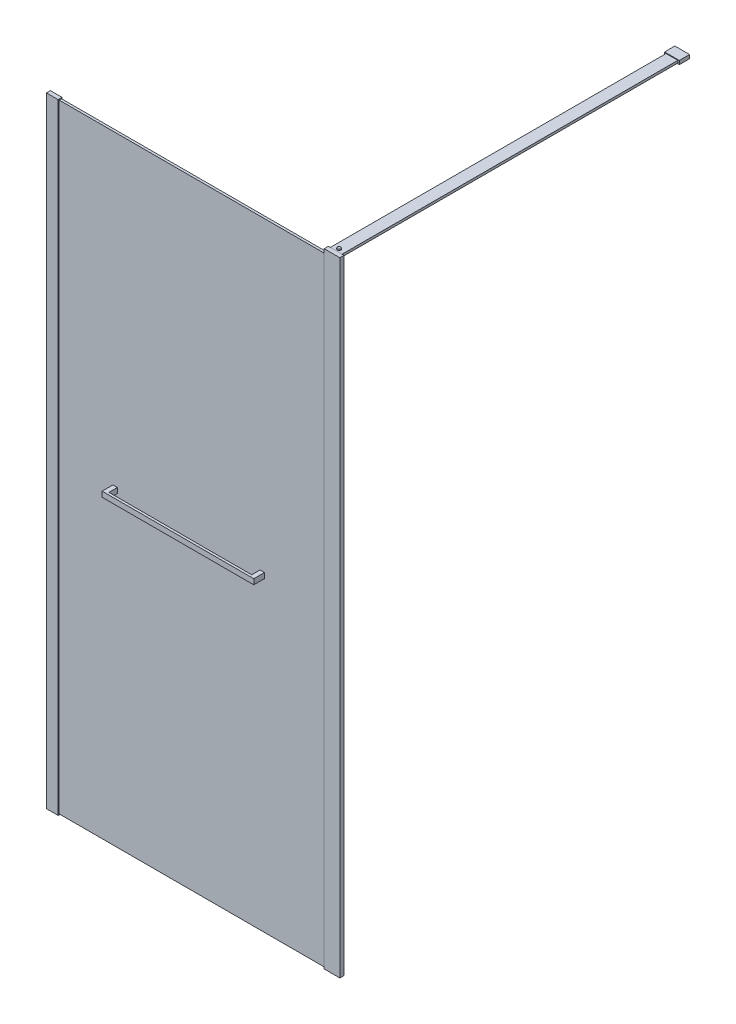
SolidWorks part; units mm, degrees
ref_plane "Płaszczyzna przednia" through (0, 0, 0) normal (0, 0, 1) x (1, 0, 0)
ref_plane "Płaszczyzna górna" through (0, 0, 0) normal (0, 1, 0) x (1, 0, 0)
ref_plane "Płaszczyzna prawa" through (0, 0, 0) normal (1, 0, 0) x (0, 0, -1)
sketch "Szkic1" plane through (0, 0, 0) normal (0, 1, 0) x (1, 0, 0)
  line L0 (0, 0) -> (0, 13.3)
  line L1 (0, 13.3) -> (40, 13.3)
  line L2 (40, 13.3) -> (40, 11.4)
  line L3 (40, 11.4) -> (6.5, 11.4)
  line L4 (6.5, 11.4) -> (6.5, 3.4)
  line L5 (6.5, 3.4) -> (40, 3.4)
  line L6 (40, 3.4) -> (40, 0)
  line L7 (40, 0) -> (0, 0)
  dimension "D1" = 40
  dimension "D2" = 13.3
  dimension "D3" = 33.5
  dimension "D4" = 1.9
  dimension "D5" = 8
extrude "Dodanie-wyciągnięcie1" add sketch "Szkic1" along normal blind 2100 from offset 3
sketch "Szkic2" plane through (0, 3, 0) normal (0, -1, 0) x (1, 0, 0)
  line L0 (6.5, -11.4) -> (40, -11.4) construction
  line L1 (6.5, -3.4) -> (953.5, -3.4)
  line L2 (6.5, -3.4) -> (6.5, -11.4)
  line L3 (6.5, -11.4) -> (953.5, -11.4)
  line L4 (953.5, -3.4) -> (953.5, -11.4)
  dimension "D1" = 947
extrude "Dodanie-wyciągnięcie2" add sketch "Szkic2" against normal blind 2100 separate body
sketch "Szkic3" plane through (0, 3, 0) normal (0, -1, 0) x (1, 0, 0)
  line L0 (943.4, -3.4) -> (943.4, -0.4)
  line L1 (953.5, -3.4) -> (6.5, -3.4) construction
  line L2 (943.4, -0.4) -> (996.4, -0.4)
  line L3 (996.4, -0.4) -> (996.4, -14.4)
  line L4 (996.4, -14.4) -> (943.4, -14.4)
  line L5 (943.4, -14.4) -> (943.4, -11.4)
  line L6 (943.4, -11.4) -> (953.5, -11.4)
  line L7 (953.5, -11.4) -> (953.5, -3.4)
  line L8 (953.5, -3.4) -> (943.4, -3.4)
  line L9 (6.5, -11.4) -> (953.5, -11.4) construction
  line L10 (953.5, -11.4) -> (953.5, -3.4) construction
  dimension "D1" = 10.1
  dimension "D2" = 3
  dimension "D3" = 3
  dimension "D4" = 53
extrude "Dodanie-wyciągnięcie3" add sketch "Szkic3" against normal blind 2108 separate body
sketch "Szkic4" plane through (0, 2103, 0) normal (0, 1, 0) x (1, 0, 0)
  line L1 (0, 13.3) -> (40, 13.3)
  line L2 (0, 13.3) -> (0, 0)
  line L3 (0, 0) -> (40, 0)
  line L4 (40, 13.3) -> (40, 0)
extrude "Dodanie-wyciągnięcie4" add sketch "Szkic4" along normal blind 3
sketch "Szkic5" plane through (0, 2111, 0) normal (0, 1, 0) x (1, 0, 0)
  line L1 (996.4, 14.4) -> (943.4, 14.4)
  line L2 (996.4, 14.4) -> (996.4, 0.4)
  line L3 (996.4, 0.4) -> (943.4, 0.4)
  line L4 (943.4, 14.4) -> (943.4, 0.4)
extrude "Dodanie-wyciągnięcie5" add sketch "Szkic5" along normal blind 8
sketch "Szkic6" plane through (943.4, 0, 0) normal (-1, 0, 0) x (0, 0, 1)
  line L0 (-11.4, 2111) -> (-3.4, 2111) construction
  line L1 (-3.35, 2111) -> (-11.45, 2111)
  line L2 (-3.35, 2111) -> (-3.35, 2103.2)
  line L3 (-3.35, 2103.2) -> (-11.45, 2103.2)
  line L4 (-11.45, 2111) -> (-11.45, 2103.2)
  point P6 (-7.4, 2111)
  dimension "D1" = 8.1
  dimension "D2" = 7.8
extrude "Dodanie-wyciągnięcie6" add sketch "Szkic6" against normal blind 15 from offset 1.3
sketch "Szkic7" plane through (0, 3, 0) normal (0, -1, 0) x (1, 0, 0)
  line L1 (943.4, -0.4) -> (996.4, -0.4)
  line L2 (943.4, -0.4) -> (943.4, -14.4)
  line L3 (943.4, -14.4) -> (996.4, -14.4)
  line L4 (996.4, -0.4) -> (996.4, -14.4)
extrude "Dodanie-wyciągnięcie7" add sketch "Szkic7" along normal blind 3
sketch "Szkic8" plane through (0, 3, 0) normal (0, -1, 0) x (1, 0, 0)
  line L1 (0, 0) -> (40, 0)
  line L2 (0, 0) -> (0, -13.3)
  line L3 (0, -13.3) -> (40, -13.3)
  line L4 (40, 0) -> (40, -13.3)
extrude "Dodanie-wyciągnięcie8" add sketch "Szkic8" along normal blind 3
sketch "Szkic9" plane through (0, 0, -14.4) normal (0, 0, -1) x (-1, 0, 0)
  line L0 (-996.4, 2119) -> (-943.4, 2119) construction
  line L1 (-989.9, 2119) -> (-949.9, 2119)
  line L2 (-989.9, 2119) -> (-989.9, 2111)
  line L3 (-989.9, 2111) -> (-949.9, 2111)
  line L4 (-949.9, 2119) -> (-949.9, 2111)
  line L5 (-996.4, 2119) -> (-996.4, 0) construction
  line L6 (-943.4, 2119) -> (-943.4, 0) construction
  dimension "D1" = 6.5
  dimension "D2" = 6.5
  dimension "D3" = 8
extrude "Dodanie-wyciągnięcie9" add sketch "Szkic9" along normal blind 1170 separate body
sketch "Szkic10" plane through (0, 0, -1184.4) normal (0, 0, -1) x (-1, 0, 0)
  line L0 (-969.9, 2119) -> (-969.9, 2115) construction
  line L1 (-994.9, 2121.25) -> (-944.9, 2121.25)
  line L2 (-994.9, 2121.25) -> (-994.9, 2108.75)
  line L3 (-994.9, 2108.75) -> (-944.9, 2108.75)
  line L4 (-944.9, 2121.25) -> (-944.9, 2108.75)
  line L5 (-994.9, 2121.25) -> (-944.9, 2108.75) construction
  line L6 (-994.9, 2108.75) -> (-944.9, 2121.25) construction
  line L7 (-949.9, 2119) -> (-989.9, 2119) construction
  line L8 (-969.9, 2115) -> (-989.9, 2115) construction
  line L9 (-989.9, 2119) -> (-989.9, 2111) construction
  point P0 (-969.9, 2115)
  dimension "D1" = 12.5
  dimension "D2" = 50
extrude "Dodanie-wyciągnięcie10" add sketch "Szkic10" along normal blind 35 from offset 29.4
ref_plane "Płaszczyzna1" through (969.9, 0, 0) normal (1, 0, 0) x (0, 0, -1)
sketch "Szkic11" plane through (969.9, 0, 0) normal (1, 0, 0) x (0, 0, -1)
  line L0 (24.4, 2119) -> (24.4, 2127.4416) construction
  line L1 (24.4, 2119) -> (34.6926, 2119) construction
  line L2 (30.3, 2119) -> (30.05, 2122.8)
  line L3 (24.4, 2124.7) -> (30.2413, 2124.7) construction
  line L4 (24.4, 2124.7) -> (24.4, 2124.2)
  line L5 (1155, 2119) -> (14.4, 2119) construction
  line L6 (14.4, 2119) -> (14.4, 2111) construction
  line L7 (29.7989, 2119) -> (30.3, 2119)
  line L9 (29.5663, 2122.5357) -> (29.7989, 2119)
  arc A0 (24.4, 2124.7) -> (30.05, 2122.8) centre (24.4, 2115.3493) cw
  arc A1 (29.5663, 2122.5357) -> (24.4, 2124.2) centre (24.4, 2115.3493) ccw
  dimension "D1" = 0.5
  dimension "D2" = 11.3
  dimension "D3" = 5.7
  dimension "D4" = 3.8
  dimension "D5" = 11.8
  dimension "D6" = 0.5
  dimension "D7" = 10
revolve "Obrót1" add sketch "Szkic11" angle 360 about L0
sketch "Szkic12" plane through (0, 0, -3.4) normal (0, 0, 1) x (1, 0, 0)
  line L0 (480, 1409.7928) -> (480, 762.3594) construction
  line L1 (230, 1053) -> (730, 1053) construction
  line L2 (6.5, 2103) -> (6.5, 3) construction
  line L3 (953.5, 2103) -> (953.5, 3) construction
  line L5 (222.5, 1062) -> (237.5, 1062)
  line L6 (222.5, 1062) -> (222.5, 1044)
  line L7 (222.5, 1044) -> (237.5, 1044)
  line L8 (237.5, 1062) -> (237.5, 1044)
  line L9 (222.5, 1062) -> (237.5, 1044) construction
  line L10 (222.5, 1044) -> (237.5, 1062) construction
  line L11 (722.5, 1062) -> (737.5, 1062)
  line L12 (722.5, 1062) -> (722.5, 1044)
  line L13 (722.5, 1044) -> (737.5, 1044)
  line L14 (737.5, 1062) -> (737.5, 1044)
  line L15 (722.5, 1062) -> (737.5, 1044) construction
  line L16 (722.5, 1044) -> (737.5, 1062) construction
  dimension "D1" = 1053
  dimension "D2" = 500
  dimension "D3" = 15
  dimension "D4" = 18
extrude "Dodanie-wyciągnięcie11" add sketch "Szkic12" along normal blind 36.5 and the other way blind 18 separate body
sketch "Szkic13" plane through (237.5, 0, 0) normal (1, 0, 0) x (0, 0, -1)
  line L0 (21.4, 1044) -> (-33.1, 1044) construction
  line L1 (-33.1, 1062) -> (-25.1, 1062)
  line L2 (-33.1, 1062) -> (-33.1, 1044)
  line L3 (-33.1, 1044) -> (-25.1, 1044)
  line L4 (-25.1, 1062) -> (-25.1, 1044)
  dimension "D1" = 8
extrude "Dodanie-wyciągnięcie12" add sketch "Szkic13" along normal up to surface (485 mm away)
